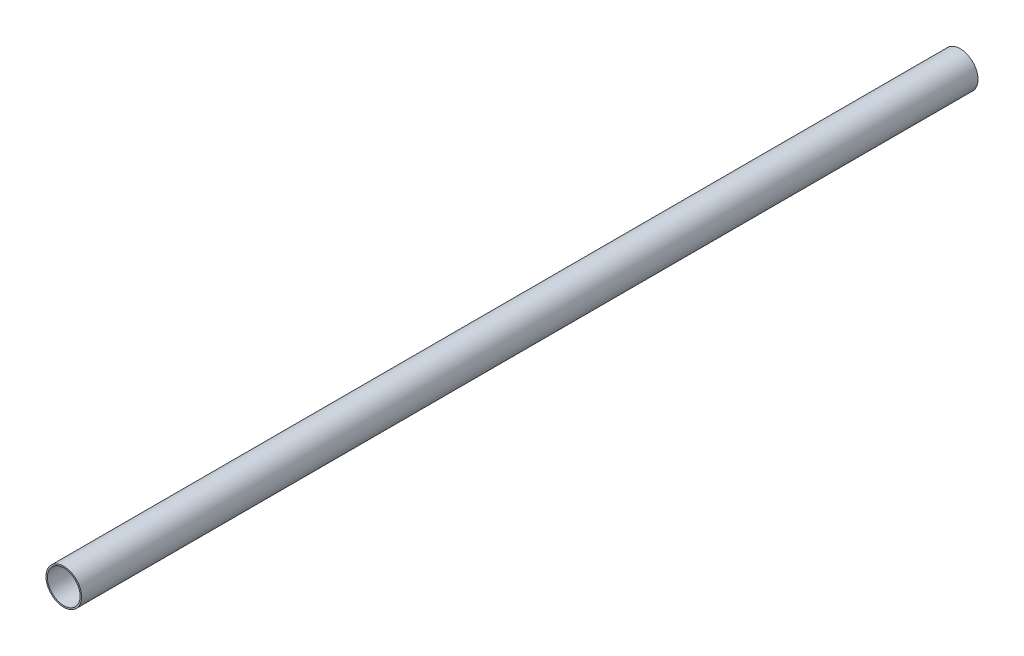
SolidWorks part; units mm, degrees
ref_plane "Plan de face" through (0, 0, 0) normal (0, 0, 1) x (1, 0, 0)
ref_plane "Plan de dessus" through (0, 0, 0) normal (0, 1, 0) x (1, 0, 0)
ref_plane "Plan de droite" through (0, 0, 0) normal (1, 0, 0) x (0, 0, -1)
sketch "Esquisse1" plane through (0, 0, 0) normal (0, 0, 1) x (1, 0, 0)
  circle A0 centre (0, 0) radius 11.5
  circle A1 centre (0, 0) radius 12.5
  dimension "D1" = 23
  dimension "D2" = 25
extrude "Extrusion1" add sketch "Esquisse1" along normal blind 630
